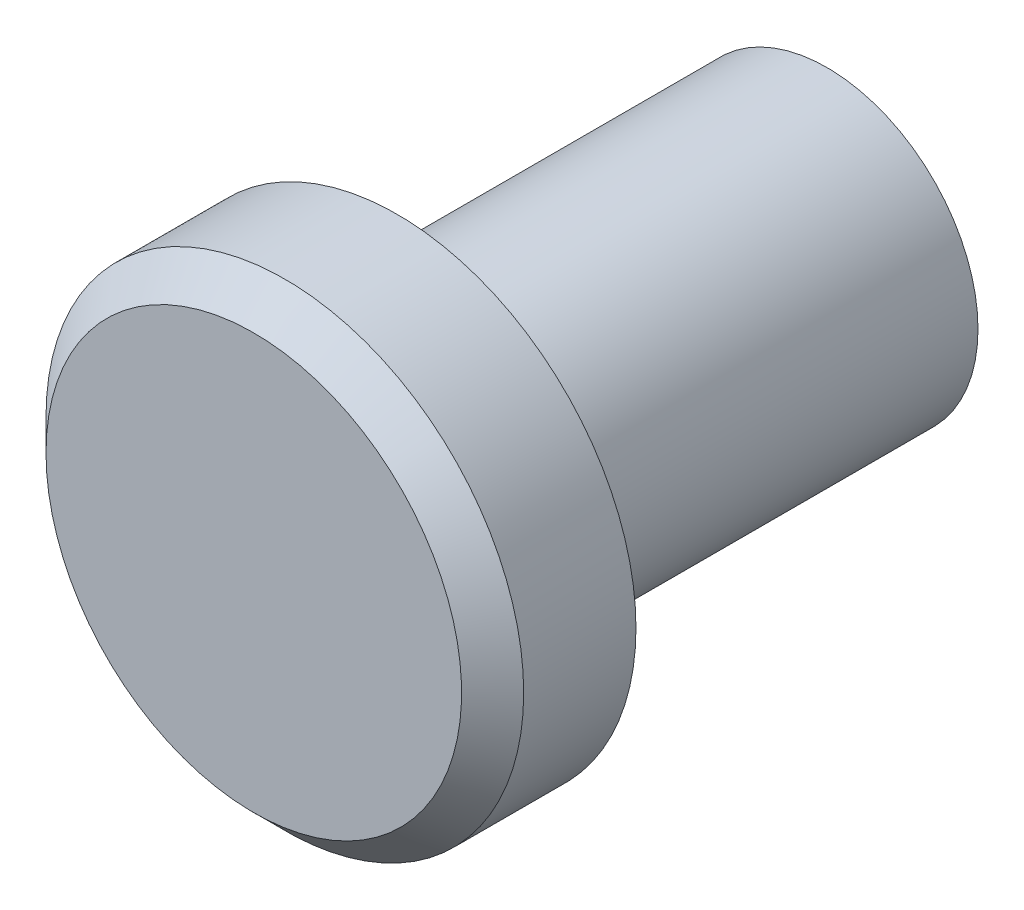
SolidWorks part; units mm, degrees
ref_plane "Front Plane" through (0, 0, 0) normal (0, 0, 1) x (1, 0, 0)
ref_plane "Top Plane" through (0, 0, 0) normal (0, 1, 0) x (1, 0, 0)
ref_plane "Right Plane" through (0, 0, 0) normal (1, 0, 0) x (0, 0, -1)
sketch "Sketch1" plane through (0, 0, 0) normal (1, 0, 0) x (0, 0, -1)
  line L0 (0, 0) -> (19.05, 0) construction
  line L1 (0, 0) -> (0, 6.35)
  line L2 (0, 6.35) -> (3.81, 6.35)
  line L3 (3.81, 6.35) -> (3.81, 4.0132)
  line L4 (3.81, 4.0132) -> (15.24, 4.0132)
  line L5 (15.24, 4.0132) -> (15.24, 2.921)
  line L6 (15.24, 2.921) -> (4.445, 2.921)
  line L7 (4.445, 2.921) -> (2.6899, 0)
  line L8 (2.6899, 0) -> (0, 0)
  dimension "D1" = 59
  dimension "D2" = 15.24
  dimension "D3" = 6.35
  dimension "D4" = 3.81
  dimension "D5" = 10.795
  dimension "D6" = 2.921
  dimension "D7" = 4.0132
revolve "Revolve1" add sketch "Sketch1" angle 360 about L0
chamfer "Chamfer1" distance 0.8255 angle 45 2 edges at (6.35, 0, 0) (2.921, 0, -15.24)
